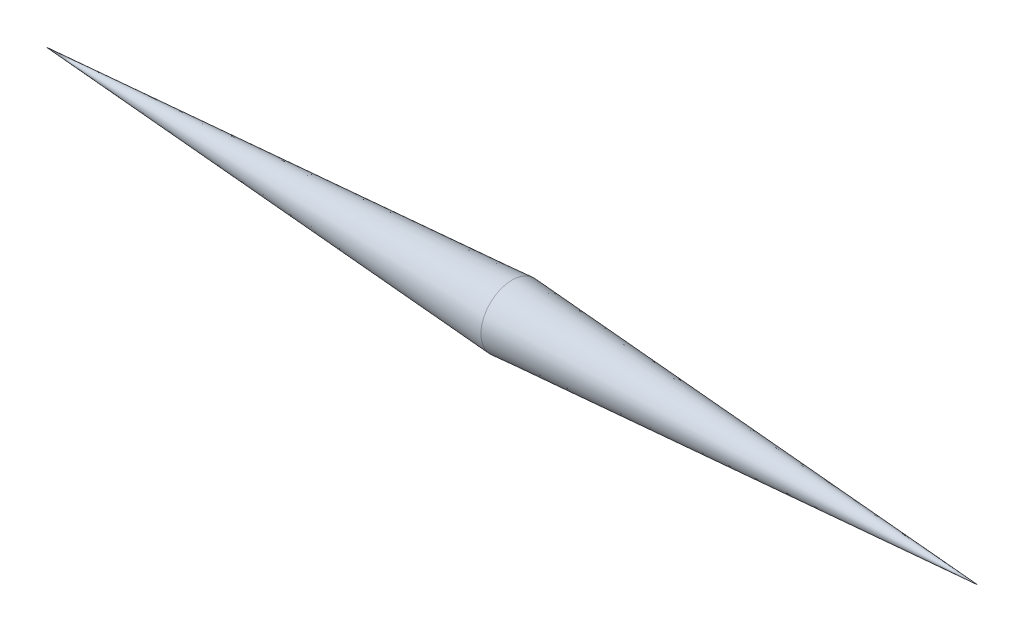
SolidWorks part; units mm, degrees
ref_plane "Alzado" through (0, 0, 0) normal (0, 0, 1) x (1, 0, 0)
ref_plane "Planta" through (0, 0, 0) normal (0, 1, 0) x (1, 0, 0)
ref_plane "Vista lateral" through (0, 0, 0) normal (1, 0, 0) x (0, 0, -1)
sketch "Croquis1" plane through (0, 0, 0) normal (0, 0, 1) x (1, 0, 0)
  line L0 (0, 0) -> (150, 0)
  line L1 (150, 0) -> (75, 5)
  line L2 (75, 5) -> (0, 0)
  dimension "D1" = 5
  dimension "D2" = 150
  dimension "D3" = 75
revolve "Revolución1" add sketch "Croquis1" angle 360 about L0
